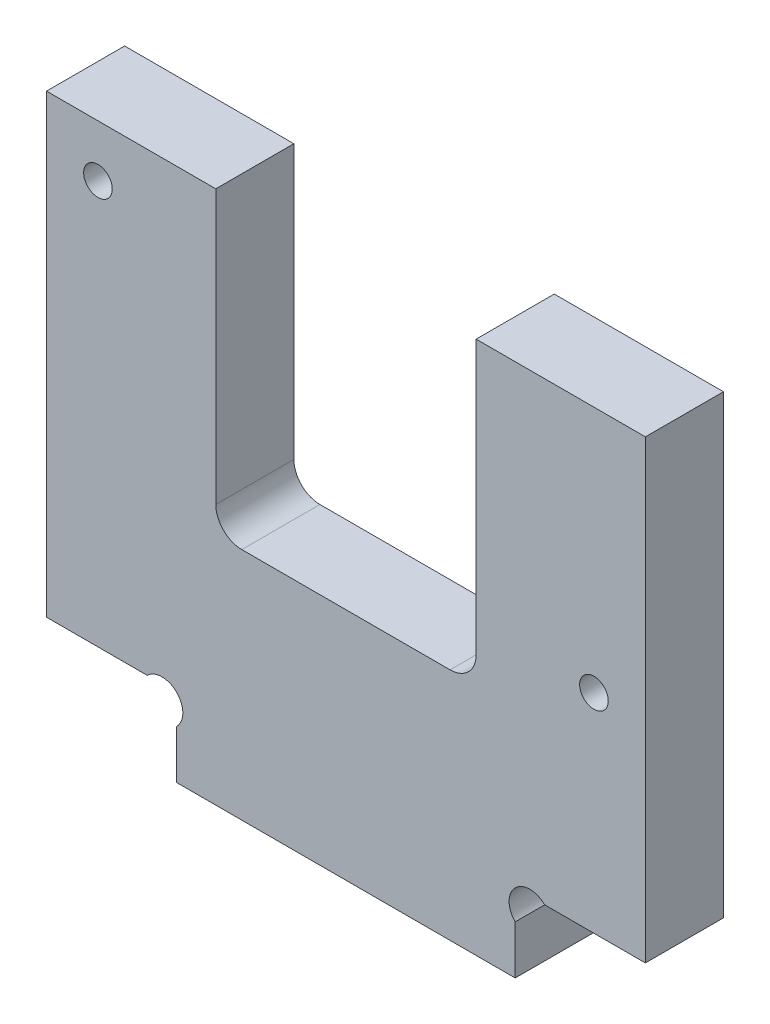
SolidWorks part; units mm, degrees
ref_plane "Plan de face" through (0, 0, 0) normal (0, 0, 1) x (1, 0, 0)
ref_plane "Plan de dessus" through (0, 0, 0) normal (0, 1, 0) x (1, 0, 0)
ref_plane "Plan de droite" through (0, 0, 0) normal (1, 0, 0) x (0, 0, -1)
sketch "Esquisse1" plane through (0, 0, 0) normal (0, 0, 1) x (1, 0, 0)
  line L0 (-4.3516, 0) -> (70.1873, 0) construction
  line L1 (10, 0) -> (36, 0)
  line L2 (0, 6) -> (0, 41)
  line L3 (0, 41) -> (13, 41)
  line L4 (46, 6) -> (46, 41)
  line L5 (0, -4.0277) -> (0, 56.0075) construction
  line L6 (70.1873, 41) -> (-3.2575, 41) construction
  line L7 (46, 6.5285) -> (46, 57.0075) construction
  line L8 (23, -5.1349) -> (23, 52.5596) construction
  line L9 (61.3542, 6) -> (-2.9481, 6) construction
  line L10 (36, 18.3294) -> (36, -5.1349) construction
  line L11 (36, 6) -> (44.5064, -2.5064) construction
  line L12 (38.2627, 6) -> (46, 6)
  line L13 (36, 3.7373) -> (36, 0)
  line L14 (10, 3.7373) -> (10, 0)
  line L15 (7.7373, 6) -> (0, 6)
  line L16 (13, 46.3208) -> (13, 32.7742) construction
  line L17 (55.6041, 18) -> (12.858, 18) construction
  line L18 (13, 41) -> (13, 20)
  line L19 (15, 18) -> (31, 18)
  line L20 (33, 20) -> (33, 41)
  line L21 (33, 41) -> (46, 41)
  line L22 (3.95, 42.6932) -> (3.95, 33.5406) construction
  line L23 (44.55, 39.5) -> (1.45, 39.5) construction
  line L24 (44.55, 39.5) -> (44.55, 19.5) construction
  line L25 (44.55, 19.5) -> (1.45, 19.5) construction
  line L26 (1.45, 39.5) -> (1.45, 19.5) construction
  line L27 (44.55, 39.5) -> (1.45, 19.5) construction
  line L28 (44.55, 19.5) -> (1.45, 39.5) construction
  line L29 (-1.907, 37) -> (6.4829, 37) construction
  line L30 (45.3866, 22) -> (37.5765, 22) construction
  line L31 (42.05, 19.0665) -> (42.05, 25.89) construction
  line L32 (33, 46.3208) -> (33, 32.7742) construction
  arc A0 (38.2627, 6) -> (36, 3.7373) centre (37.1314, 4.8686) ccw
  arc A1 (7.7373, 6) -> (10, 3.7373) centre (8.8686, 4.8686) cw
  circle A2 centre (42.05, 22) radius 1.1
  circle A3 centre (3.95, 37) radius 1.1
  arc A6 (31, 18) -> (33, 20) centre (31, 20) ccw
  arc A7 (13, 20) -> (15, 18) centre (15, 20) ccw
  point P33 (23, 29.5)
  point P72 (13, 18)
  dimension "D7" = 10
  dimension "D16" = 10
  dimension "D19" = 2
  dimension "D1" = 46
  dimension "D2" = 41
  dimension "D3" = 23
  dimension "D4" = 6
  dimension "D5" = 13
  dimension "D6" = 45
  dimension "D8" = 12
  dimension "D9" = 1.5
  dimension "D10" = 20
  dimension "D11" = 43.1
  dimension "D12" = 2.5
  dimension "D13" = 2.5
  dimension "D14" = 2.5
  dimension "D15" = 2.5
extrude "Boss.-Extru.1" add sketch "Esquisse1" along normal blind 6
